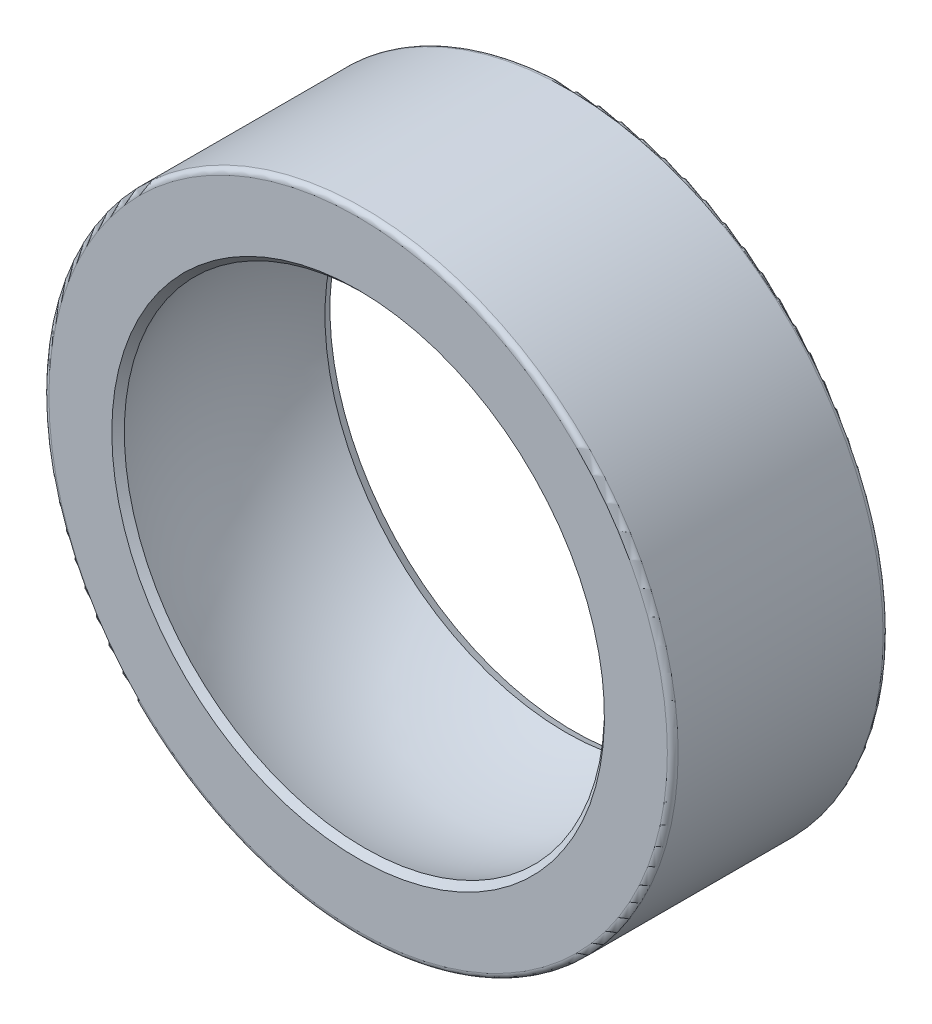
SolidWorks part; units mm, degrees
ref_plane "Face" through (0, 0, 0) normal (0, 0, 1) x (1, 0, 0)
ref_plane "Dessus" through (0, 0, 0) normal (0, 1, 0) x (1, 0, 0)
ref_plane "Droite" through (0, 0, 0) normal (1, 0, 0) x (0, 0, -1)
sketch "Esquisse1" plane through (0, 0, 0) normal (1, 0, 0) x (0, 0, -1)
  line L0 (-24.6973, 0) -> (35.632, 0) construction
  line L1 (-6, 17.5) -> (6, 17.5)
  line L2 (6, 17.5) -> (6, 13.2004)
  line L3 (-6, 17.5) -> (-6, 13.2004)
  line L4 (0, 34.7583) -> (0, -7.3104) construction
  arc A1 (6, 13.2004) -> (-6, 13.2004) centre (0, 0) ccw
  point P11 (0, 17.5)
  dimension "D2" = 14.5
  dimension "D1" = 35
  dimension "D3" = 12
revolve "Base-Révolution" add sketch "Esquisse1" angle 360 about L0
fillet "Congé1" radius 0.3
chamfer "Chanfrein1" distance 0.5 angle 45
